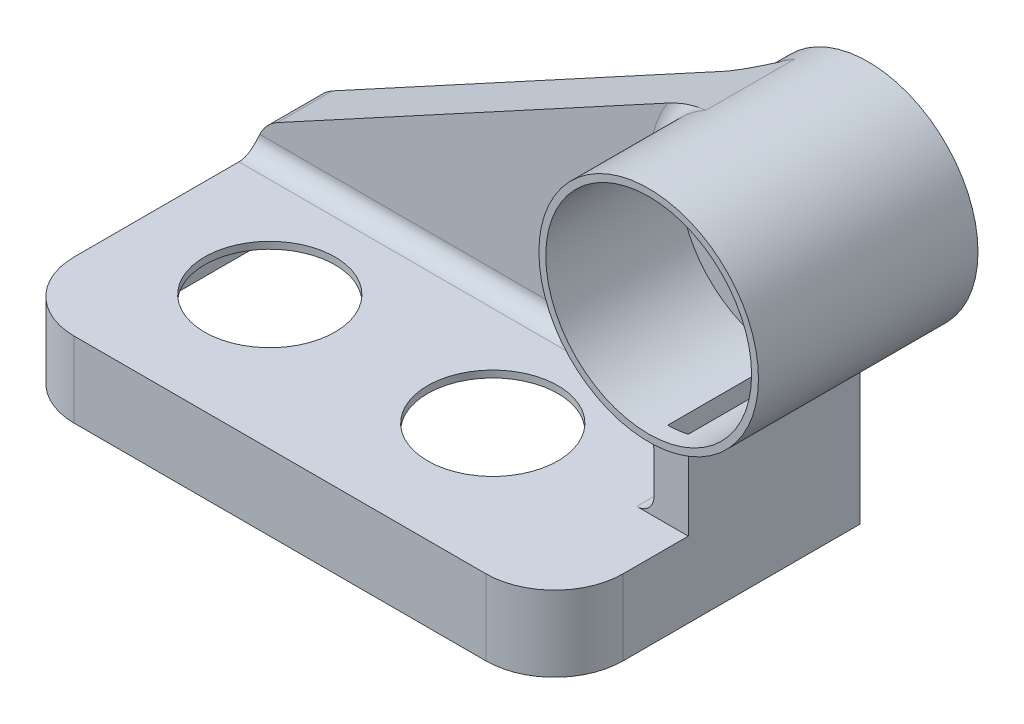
SolidWorks part; units mm, degrees
ref_plane "Front" through (0, 0, 0) normal (0, 0, 1) x (1, 0, 0)
ref_plane "Top" through (0, 0, 0) normal (0, 1, 0) x (1, 0, 0)
ref_plane "Right" through (0, 0, 0) normal (1, 0, 0) x (0, 0, -1)
sketch "Sketch1" plane through (0, 0, 0) normal (0, 1, 0) x (1, 0, 0)
  line L0 (0, 0) -> (160, 0)
  line L1 (0, 0) -> (0, 89)
  line L2 (160, 89) -> (0, 89)
  line L3 (160, 89) -> (160, 0)
  dimension "D3" = 89
  dimension "D4" = 160
extrude "Base_Plate" add sketch "Sketch1" along normal blind 22
fillet "Base_Fillet" radius 20 2 edges at (0, 11, 0) (160, 11, 0)
sketch "Sketch2" plane through (0, 0, -89) normal (0, 0, -1) x (-1, 0, 0)
  line L1 (-20, 0) -> (-140, 0) construction
  line L2 (-160, 22) -> (0, 22) construction
  line L3 (-160, 22) -> (0, 22)
  line L4 (-160, 22) -> (-160, 0) construction
  line L5 (-160, 22) -> (-160, 44.1629)
  line L6 (-6.2715, 32.5444) -> (-136.1758, 103.1184)
  line L8 (0, 0) -> (0, 22) construction
  arc A0 (-136.1758, 103.1184) -> (-160, 44.1629) centre (-151.4519, 75) ccw
  arc A1 (0, 22) -> (-6.2715, 32.5444) centre (-12, 22) ccw
  dimension "D1" = 64
  dimension "D4" = 12
  dimension "D3" = 151.4519
  dimension "D2" = 75
extrude "Vertical_Plate" add sketch "Sketch2" against normal blind 16
ref_plane "Circular_Plane" through (0, 0, -100) normal (0, 0, -1) x (-1, 0, 0)
sketch "Sketch3" plane through (0, 0, -100) normal (0, 0, -1) x (-1, 0, 0)
  circle A0 centre (-151.4519, 75) radius 32
  arc A1 (-136.1758, 103.1184) -> (-160, 44.1629) centre (-151.4519, 75) ccw construction
extrude "Circular_Boss" add sketch "Sketch3" against normal blind 64
sketch "Sketch4" plane through (0, 22, 0) normal (0, 1, 0) x (-1, 0, 0)
  line L1 (-119.4519, -73) -> (-160, -73) construction
  line L2 (-150, -73) -> (-150, -39)
  line L3 (-160, -73) -> (-160, -20) construction
  line L5 (-160, -73) -> (-160, -39)
  line L7 (-160, -73) -> (-150, -73)
  line L8 (-160, -39) -> (-150, -39)
  dimension "D1" = 10
  dimension "D2" = 34
extrude "Rib_Under" add sketch "Sketch4" along normal up to next
shell "Wall_Thickness" thickness 2
hole_wizard "CounterBore" positions "Sketch5" profile "Sketch6" legacy
sketch "Sketch5" plane through (0, 22, 0) normal (0, 1, 0) x (-1, 0, 0)
  line L0 (0, -20) -> (0, -73) construction
  line L2 (-6.2715, -89) -> (-136.1758, -89) construction
  point P0 (-38, -39)
  dimension "D1" = 38
  dimension "D2" = 50
sketch "Sketch6" plane through (38, 22, -39) normal (1, 0, 0) x (0, 0, 1)
  line L0 (0, 0) -> (0, 22)
  line L1 (0, 22) -> (12, 22)
  line L2 (12, 22) -> (12, 2)
  line L3 (12, 2) -> (19, 2)
  line L4 (19, 2) -> (19, 0)
  line L5 (19, 0) -> (0, 0)
pattern_linear "LPattern1" count 2 spacing 65 along (1, 0, 0) of "CounterBore"
fillet "Rib_Fillet" radius 5 3 edges at (150, 43.033, -56) (150, 22, -56)
fillet "Circ_Fillet" radius 5 7 edges at (150, 32.7834, -73) (119.8667, 69.864, -73) (148.8314, 41.7794, -73) (148.5355, 23.4645, -73) (121.7828, 63.0106, -89)
